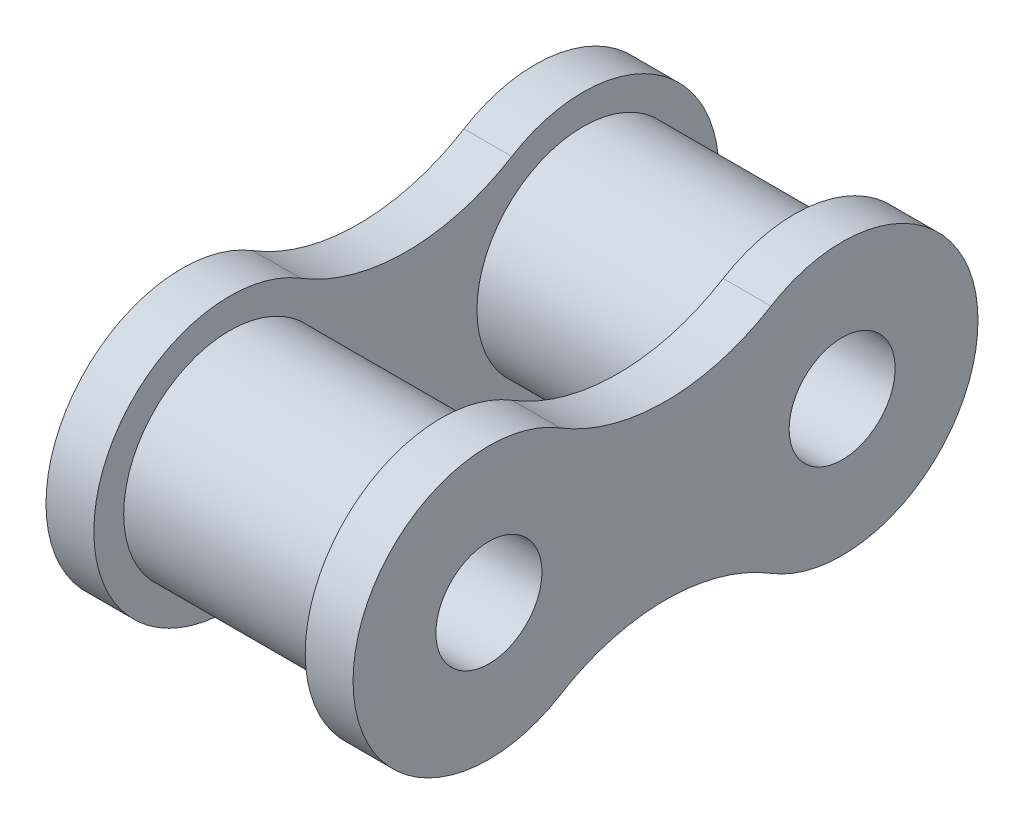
SolidWorks part; units mm, degrees
ref_plane "Płaszczyzna przednia" through (0, 0, 0) normal (0, 0, 1) x (1, 0, 0)
ref_plane "Płaszczyzna górna" through (0, 0, 0) normal (0, 1, 0) x (1, 0, 0)
ref_plane "Płaszczyzna prawa" through (0, 0, 0) normal (1, 0, 0) x (0, 0, -1)
sketch "Szkic1" plane through (0, 0, 0) normal (1, 0, 0) x (0, 0, -1)
  circle A0 centre (31.75, 0) radius 4.765
  circle A1 centre (0, 0) radius 4.765
  arc A6 (25.3572, -10.4027) -> (25.3572, 10.4027) centre (31.75, 0) ccw
  arc A7 (6.3928, 10.4027) -> (25.3572, 10.4027) centre (15.875, 25.8326) ccw
  arc A8 (6.3928, 10.4027) -> (6.3928, -10.4027) centre (0, 0) ccw
  arc A9 (25.3572, -10.4027) -> (6.3928, -10.4027) centre (15.875, -25.8326) ccw
extrude "Dodanie-wyciągnięcie1" add sketch "Szkic1" along normal blind 4.3
sketch "Szkic3" plane through (0, 0, 0) normal (-1, 0, 0) x (0, 0, 1)
  circle A0 centre (-31.75, 0) radius 4.765 construction
  circle A1 centre (0, 0) radius 4.765 construction
  circle A2 centre (-31.75, 0) radius 4.765
  circle A3 centre (0, 0) radius 4.765
  circle A4 centre (-31.75, 0) radius 9.525
  circle A5 centre (0, 0) radius 9.525
  dimension "D1" = 4.76
extrude "Dodanie-wyciągnięcie2" add sketch "Szkic3" along normal blind 19
sketch "Szkic5" plane through (-19, 0, 0) normal (-1, 0, 0) x (0, 0, 1)
  circle A0 centre (0, 0) radius 4.765
  circle A1 centre (0, 0) radius 4.765
  circle A2 centre (-31.75, 0) radius 4.765 construction
  circle A3 centre (-31.75, 0) radius 4.765
  arc A6 (-25.3572, 10.4027) -> (-6.3928, 10.4027) centre (-15.875, 25.8326) ccw
  arc A7 (-6.3928, -10.4027) -> (-6.3928, 10.4027) centre (0, 0) ccw
  arc A8 (-6.3928, -10.4027) -> (-25.3572, -10.4027) centre (-15.875, -25.8326) ccw
  arc A9 (-25.3572, 10.4027) -> (-25.3572, -10.4027) centre (-31.75, 0) ccw
extrude "Dodanie-wyciągnięcie4" add sketch "Szkic5" along normal blind 4.3 contours A8 A9 A6 A7 | A0
ref_plane "Płaszczyzna1" through (-9.5, 0, 0) normal (-1, 0, 0) x (0, 0, 1)
sketch "Szkic7" plane through (-9.5, 0, 0) normal (-1, 0, 0) x (0, 0, 1)
  point P0 (-31.75, 0)
  point P1 (0, 0)
